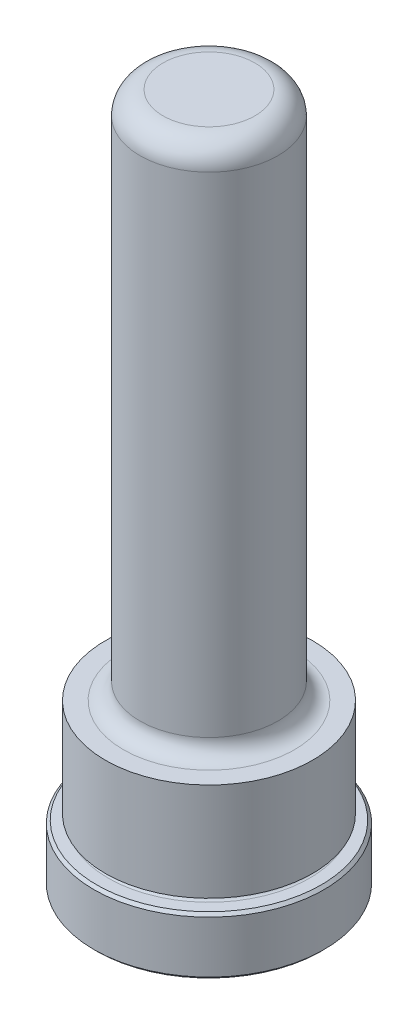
SolidWorks part; units mm, degrees
ref_plane "Front Plane" through (0, 0, 0) normal (0, 0, 1) x (1, 0, 0)
ref_plane "Top Plane" through (0, 0, 0) normal (0, 1, 0) x (1, 0, 0)
ref_plane "Right Plane" through (0, 0, 0) normal (1, 0, 0) x (0, 0, -1)
sketch "Sketch1" plane through (0, 0, 0) normal (1, 0, 0) x (0, 0, -1)
  line L0 (0, 0) -> (15.875, 0)
  line L1 (15.875, 0) -> (15.875, 7.9248)
  line L2 (15.875, 7.9248) -> (13.8938, 7.9248)
  line L3 (13.5128, 2.6782) -> (13.5128, 5.9795) construction
  line L4 (13.8938, 8.6868) -> (14.3002, 8.6868)
  line L5 (14.3002, 8.6868) -> (14.3002, 22.225)
  line L6 (14.3002, 22.225) -> (11.7983, 22.225)
  line L7 (9.5123, 24.511) -> (9.5123, 95.25)
  line L9 (9.5123, 95.25) -> (0, 95.25)
  line L10 (0, 95.25) -> (0, 0)
  line L11 (0, 0) -> (0, -7.2694) construction
  arc A0 (13.8938, 8.6868) -> (13.8938, 7.9248) centre (13.8938, 8.3058) ccw
  arc A1 (11.7983, 22.225) -> (9.5123, 24.511) centre (11.7983, 24.511) cw
  point P2 (9.5123, 95.25)
  point P14 (9.5123, 95.104)
  point P19 (9.5123, 22.225)
  dimension "D14" = 0.762
  dimension "D8" = 2.286
  dimension "T" = 7.9248
  dimension "D2" = 0.762
  dimension "M" = 31.75
  dimension "B" = 28.6004
  dimension "L" = 95.25
  dimension "D7" = 0.7874
  dimension "A" = 22.225
  dimension "D" = 19.0246
  dimension "D15" = 73.025
revolve "Revolve1" add sketch "Sketch1" angle 360 about L11
chamfer "Chamfer1" distance 0.381 angle 45 2 edges at (0, 0, 15.875) (0, 7.9248, 15.875)
fillet "Fillet1" radius 3.175 1 edges at (0, 95.25, 9.5123)
